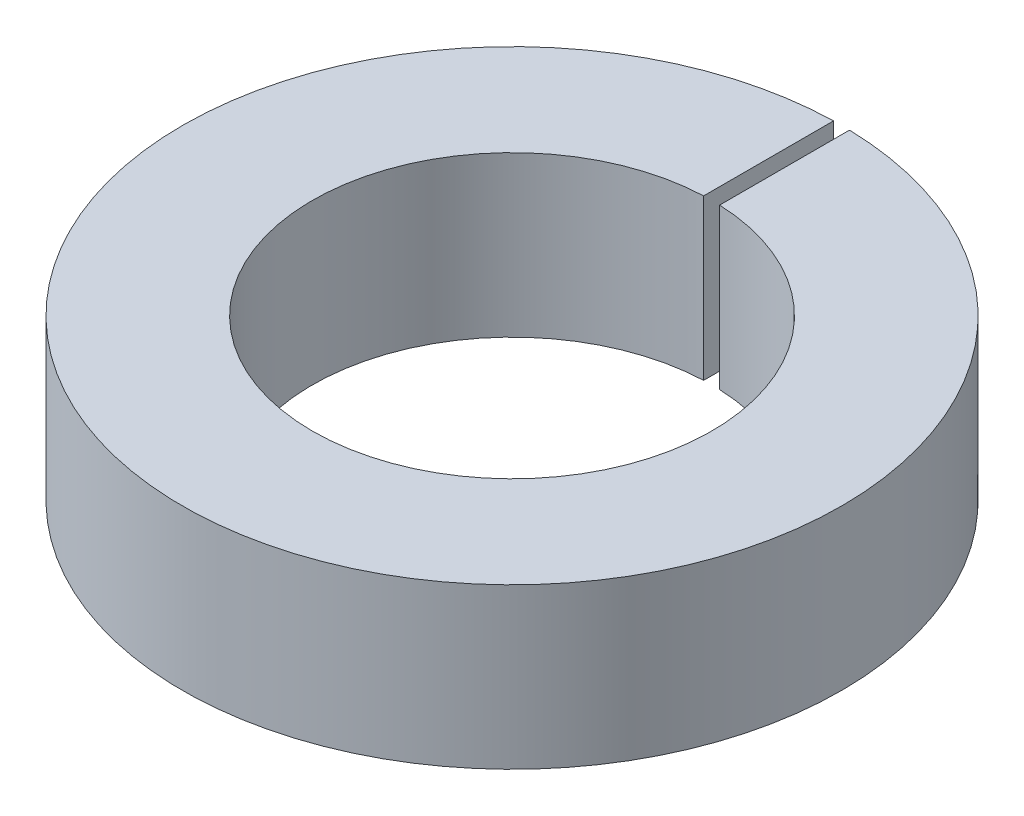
SolidWorks part; units mm, degrees
ref_plane "Front Plane" through (0, 0, 0) normal (0, 0, 1) x (1, 0, 0)
ref_plane "Top Plane" through (0, 0, 0) normal (0, 1, 0) x (1, 0, 0)
ref_plane "Right Plane" through (0, 0, 0) normal (1, 0, 0) x (0, 0, -1)
sketch "Sketch1" plane through (0, 0, 0) normal (0, 1, 0) x (1, 0, 0)
  circle A0 centre (0, 0) radius 15.875
  circle A1 centre (0, 0) radius 26.1937
  dimension "D1" = 31.75
  dimension "D2" = 52.3875
extrude "Extrude1" add sketch "Sketch1" along normal blind 12.7
sketch "Sketch2" plane through (0, 12.7, 0) normal (0, 1, 0) x (-1, 0, 0)
  line L1 (0.635, -35.56) -> (-0.635, -35.56)
  line L2 (0.635, -35.56) -> (0.635, 15.24)
  line L3 (0.635, 15.24) -> (-0.635, 15.24)
  line L4 (-0.635, -35.56) -> (-0.635, 15.24)
  circle A0 centre (0, 0) radius 15.875 construction
  dimension "D1" = 50.8
  dimension "D2" = 1.27
  dimension "D3" = 0.635
  dimension "D4" = 15.24
extrude "Cut-Extrude1" cut sketch "Sketch2" against normal through all
equation "\"D3@Sketch2\" = \"D2@Sketch2\"/2"
